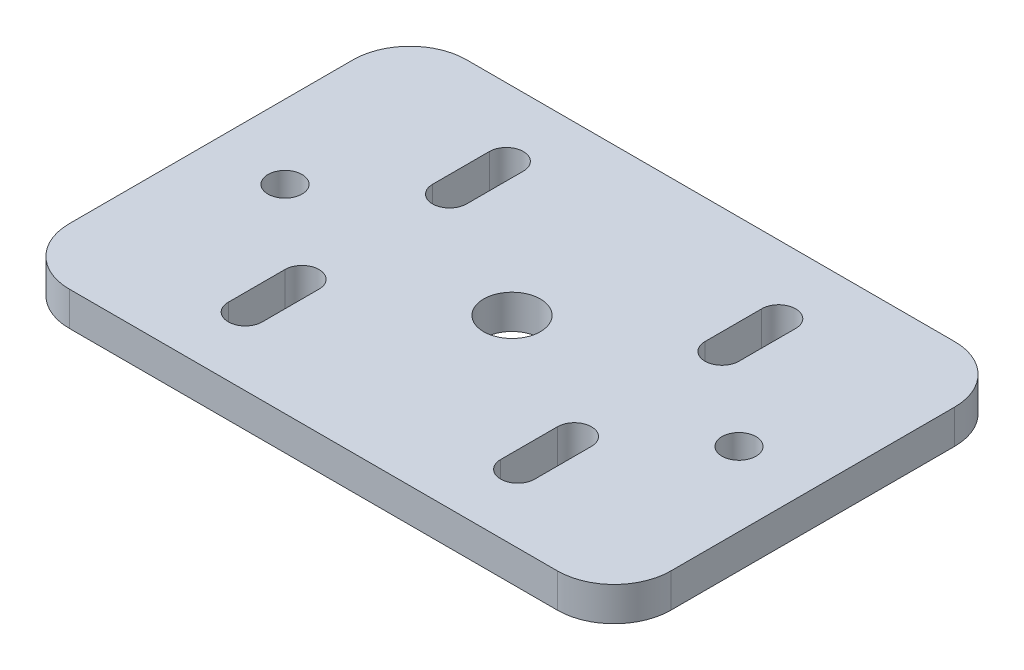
SolidWorks part; units mm, degrees
ref_plane "Front Plane" through (0, 0, 0) normal (0, 0, 1) x (1, 0, 0)
ref_plane "Top Plane" through (0, 0, 0) normal (0, 1, 0) x (1, 0, 0)
ref_plane "Right Plane" through (0, 0, 0) normal (1, 0, 0) x (0, 0, -1)
sketch "Sketch1" plane through (0, 0, 0) normal (0, 1, 0) x (1, 0, 0)
  line L0 (0, 35) -> (106, 35) construction
  line L1 (0, 0) -> (106, 0)
  line L2 (0, 0) -> (0, 70)
  line L3 (0, 70) -> (106, 70)
  line L4 (106, 0) -> (106, 70)
  line L5 (26, 58) -> (26, 48)
  line L6 (32, 58) -> (32, 48)
  line L7 (80, 58) -> (80, 48)
  line L8 (74, 58) -> (74, 48)
  line L9 (32, 22) -> (32, 12)
  line L10 (26, 22) -> (26, 12)
  line L11 (80, 22) -> (80, 12)
  line L12 (74, 22) -> (74, 12)
  circle A0 centre (53, 35) radius 5
  circle A1 centre (13, 35) radius 3
  circle A2 centre (93, 35) radius 3
  arc A3 (32, 58) -> (26, 58) centre (29, 58) ccw
  arc A4 (26, 48) -> (32, 48) centre (29, 48) ccw
  arc A5 (80, 58) -> (74, 58) centre (77, 58) ccw
  arc A6 (74, 48) -> (80, 48) centre (77, 48) ccw
  arc A7 (32, 22) -> (26, 22) centre (29, 22) ccw
  arc A8 (26, 12) -> (32, 12) centre (29, 12) ccw
  arc A9 (80, 22) -> (74, 22) centre (77, 22) ccw
  arc A10 (74, 12) -> (80, 12) centre (77, 12) ccw
  dimension "D3" = 6
  dimension "D4" = 6
  dimension "D5" = 10
  dimension "D6" = 13
  dimension "D7" = 13
  dimension "D8" = 3
  dimension "D9" = 10
  dimension "D10" = 13
  dimension "D11" = 29
  dimension "D1" = 70
  dimension "D2" = 106
extrude "Extrude1" add sketch "Sketch1" along normal blind 6
fillet "Fillet1" radius 10 4 edges at (0, 3, -70) (106, 3, -70) (106, 3, 0) (0, 3, 0)
